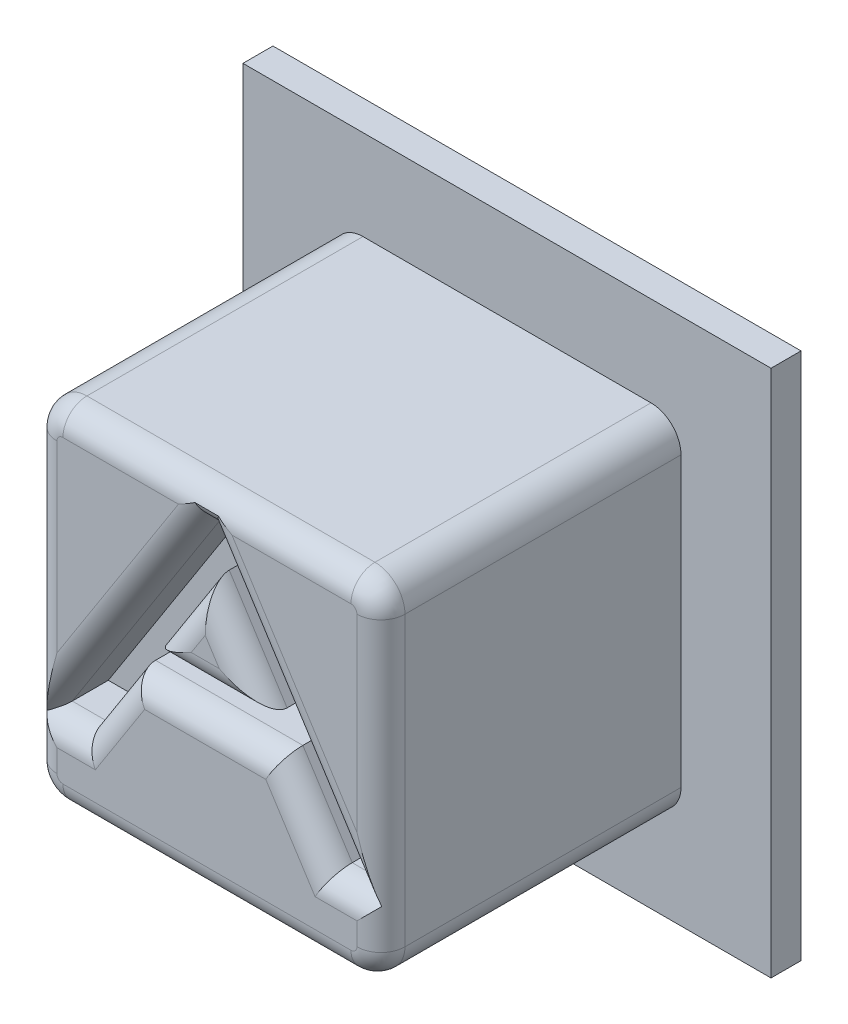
SolidWorks part; units mm, degrees
ref_plane "Plan de face" through (0, 0, 0) normal (0, 0, 1) x (1, 0, 0)
ref_plane "Plan de dessus" through (0, 0, 0) normal (0, 1, 0) x (1, 0, 0)
ref_plane "Plan de droite" through (0, 0, 0) normal (1, 0, 0) x (0, 0, -1)
sketch "Esquisse1" plane through (0, 0, 0) normal (0, 0, 1) x (1, 0, 0)
  line L1 (-2.9, 2.9) -> (2.9, 2.9)
  line L2 (-2.9, 2.9) -> (-2.9, -2.9)
  line L3 (-2.9, -2.9) -> (2.9, -2.9)
  line L4 (2.9, 2.9) -> (2.9, -2.9)
  line L5 (-2.9, 2.9) -> (2.9, -2.9) construction
  line L6 (-2.9, -2.9) -> (2.9, 2.9) construction
  point P0 (0, 0)
  dimension "D1" = 5.8
  dimension "D2" = 5.8
extrude "Boss.-Extru.1" add sketch "Esquisse1" along normal blind 5
sketch "Esquisse2" plane through (0, 0, 0) normal (0, 0, -1) x (-1, 0, 0)
  line L8 (-4.4, 4.4) -> (-4.4, -4.4)
  line L9 (-4.4, -4.4) -> (4.4, -4.4)
  line L10 (4.4, -4.4) -> (4.4, 4.4)
  line L11 (4.4, 4.4) -> (-4.4, 4.4)
  line L12 (-4.4, 4.4) -> (-4.4, -4.4)
  line L13 (-4.4, -4.4) -> (4.4, -4.4)
  line L14 (4.4, -4.4) -> (4.4, 4.4)
  line L15 (4.4, 4.4) -> (-4.4, 4.4)
  dimension "D1" = 1.5
extrude "Boss.-Extru.2" add sketch "Esquisse2" along normal blind 1
chamfer "Chanfrein1" distance 0.5 angle 45 4 edges at (0, -4.4, -1) (-4.4, 0, -1) (0, 4.4, -1) (4.4, 0, -1)
sketch "Esquisse3" plane through (0, 0, 5) normal (0, 0, 1) x (1, 0, 0)
  line L0 (-2.9, -1.6255) -> (2.9, -1.6255) construction
  line L1 (-2.9, 2.9) -> (-2.9, -2.9) construction
  line L2 (2.9, -2.9) -> (2.9, 2.9) construction
  text T0 "A" font "Century Gothic" height 4
extrude "Enlèv. mat.-Extru.1" cut sketch "Esquisse3" against normal blind 1
fillet "Congé2" radius 0.4 12 edges at (-2.3607, -1.6255, 5) (-1.6672, -0.9845, 5) (-0.0286, -0.3435, 5) (1.6104, -0.9845, 5) (2.3043, -1.6255, 5) (1.3051, 0.3745, 5) (-0.0282, 2.3745, 5) (-1.3615, 0.3745, 5) (0, -2.9, 5) (-2.9, 0, 5) (0, 2.9, 5) (2.9, 0, 5)
fillet "Congé4" radius 0.5 8 edges at (-2.7828, -2.7828, 4.8828) (2.7828, -2.7828, 4.8828) (2.7828, 2.7828, 4.8828) (-2.7828, 2.7828, 4.8828) (-2.9, -2.9, 2.3) (2.9, -2.9, 2.3) (2.9, 2.9, 2.3) (-2.9, 2.9, 2.3)
fillet "Congé5" radius 0.4 3 edges at (-0.0282, 0.0668, 5) (0.4542, 0.8196, 5) (-0.5106, 0.8196, 5)
